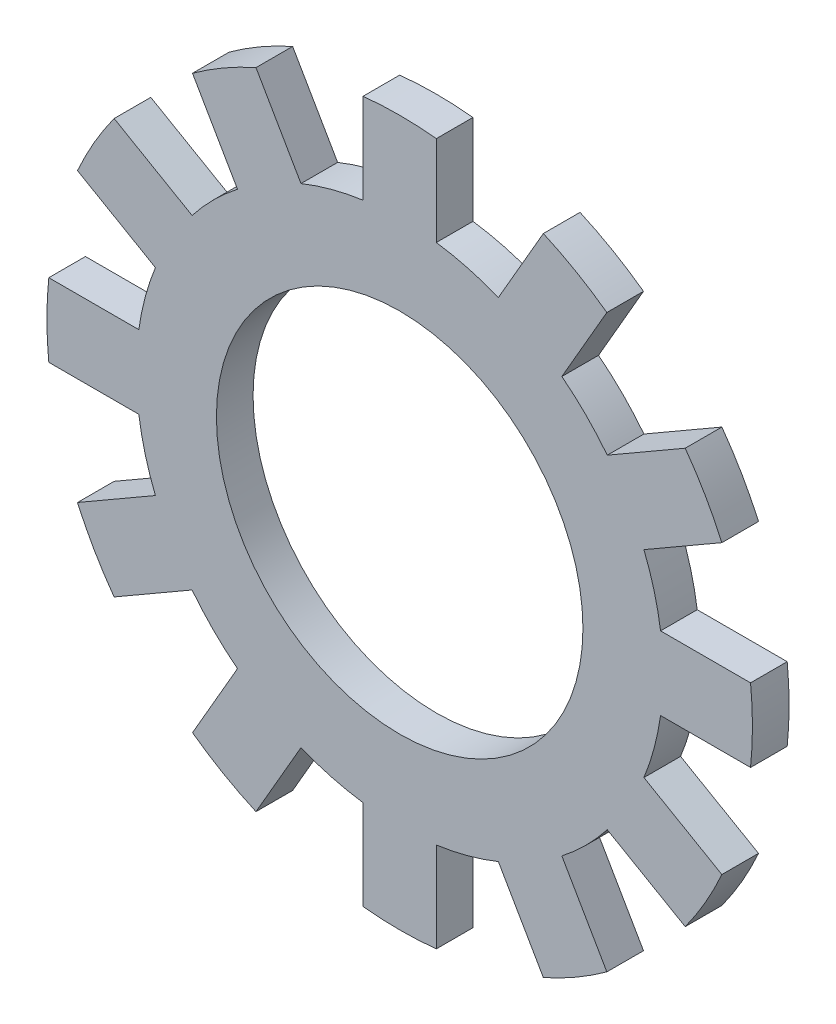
SolidWorks part; units mm, degrees
ref_plane "Front Plane" through (0, 0, 0) normal (0, 0, 1) x (1, 0, 0)
ref_plane "Top Plane" through (0, 0, 0) normal (0, 1, 0) x (1, 0, 0)
ref_plane "Right Plane" through (0, 0, 0) normal (1, 0, 0) x (0, 0, -1)
sketch "Sketch1" plane through (0, 0, 0) normal (0, 0, 1) x (1, 0, 0)
  circle A0 centre (0, 0) radius 4
  circle A1 centre (0, 0) radius 5.75
  dimension "D1" = 8
  dimension "D2" = 11.5
extrude "Boss-Extrude1" add sketch "Sketch1" along normal mid plane 0.8
sketch "Sketch2" plane through (0, 0, 0) normal (0, 0, 1) x (1, 0, 0)
  line L0 (0, 2.6811) -> (0, -2.8425) construction
sketch "Sketch3" plane through (0, 0, 0) normal (0, 0, 1) x (1, 0, 0)
  line L0 (-0.8, 7.6583) -> (-0.8, 5.6941)
  line L2 (0, 2.6811) -> (0, -2.8425) construction
  line L3 (0, 5.75) -> (0, 7.7)
  arc A0 (0, 7.7) -> (-0.8, 7.6583) centre (0, 0) ccw
  arc A1 (0, 5.75) -> (-0.8, 5.6941) centre (0, 0) ccw
  circle A2 centre (0, 0) radius 5.75 construction
  dimension "D2" = 7.7
  dimension "D1" = 0.8
extrude "Boss-Extrude2" add sketch "Sketch3" along normal mid plane 0.8
mirror "Mirror1" about plane through (0, 0, 0) normal (1, 0, 0) of "Boss-Extrude2"
pattern_circular "CirPattern2" count 12 over 360 about axis through (0, 0, 0) along (0, 0, 1) of "Boss-Extrude2", "Mirror1"
